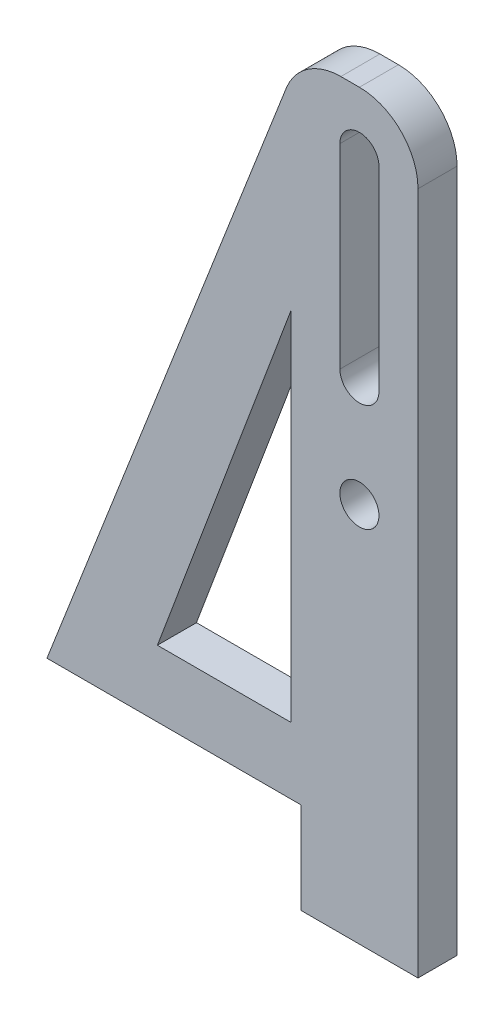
SolidWorks part; units mm, degrees
ref_plane "Plan de face" through (0, 0, 0) normal (0, 0, 1) x (1, 0, 0)
ref_plane "Plan de dessus" through (0, 0, 0) normal (0, 1, 0) x (1, 0, 0)
ref_plane "Plan de droite" through (0, 0, 0) normal (1, 0, 0) x (0, 0, -1)
sketch "Esquisse1" plane through (0, 0, 0) normal (0, 0, 1) x (1, 0, 0)
  line L1 (12, 16.2014) -> (18, 16.2014)
  line L2 (12, 16.2014) -> (12, 20.8817)
  line L3 (12, 54.2014) -> (18, 54.2014)
  line L4 (18, 16.2014) -> (18, 54.2014)
  line L6 (15, 54.2014) -> (15, 38.7977) construction
  line L7 (15, 51.2014) -> (15, 41.2014) construction
  line L8 (16, 51.2014) -> (16, 41.2014)
  line L9 (14, 51.2014) -> (14, 41.2014)
  line L10 (12, 54.2014) -> (-1, 20.8817)
  line L11 (-1, 20.8817) -> (12, 20.8817)
  line L13 (11.5, 42.5546) -> (4.6558, 24.2852)
  line L14 (4.6558, 24.2852) -> (11.5, 24.2852)
  line L15 (11.5, 24.2852) -> (11.5, 42.5546)
  arc A0 (16, 51.2014) -> (14, 51.2014) centre (15, 51.2014) ccw
  arc A1 (14, 41.2014) -> (16, 41.2014) centre (15, 41.2014) ccw
  circle A2 centre (15, 35.7014) radius 1
  point P12 (15, 46.2014)
  dimension "D4" = 1
  dimension "D7" = 2
  dimension "D1" = 6
  dimension "D2" = 6
  dimension "D3" = 38
  dimension "D5" = 10
  dimension "D9" = 3
extrude "Boss.-Extru.1" add sketch "Esquisse1" along normal blind 2
fillet "Congé1" radius 3 2 edges at (12, 54.2014, 1) (18, 54.2014, 1)
